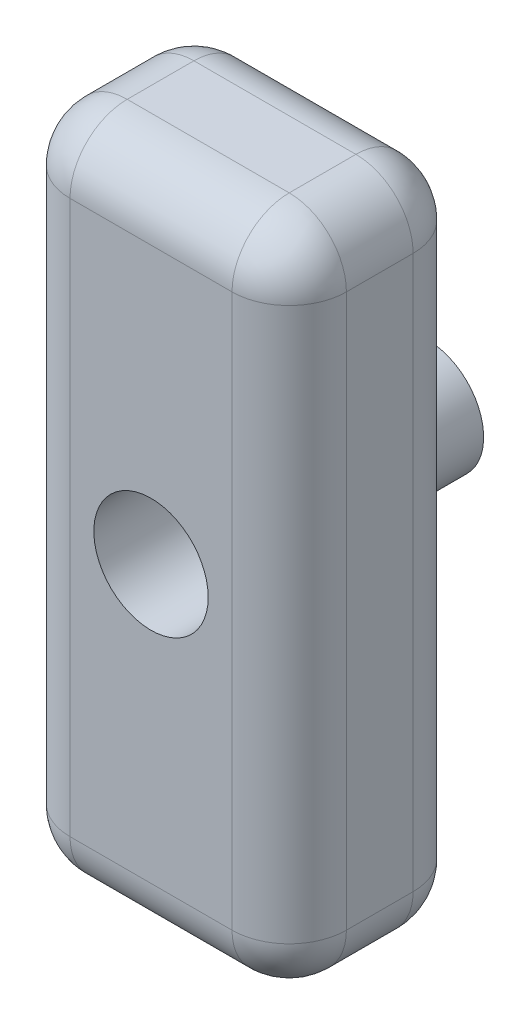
SolidWorks part; units mm, degrees
ref_plane "Спереди" through (0, 0, 0) normal (0, 0, 1) x (1, 0, 0)
ref_plane "Сверху" through (0, 0, 0) normal (0, 1, 0) x (1, 0, 0)
ref_plane "Справа" through (0, 0, 0) normal (1, 0, 0) x (0, 0, -1)
sketch "Эскиз2" plane through (0, 0, 0) normal (0, 0, 1) x (1, 0, 0)
  line L0 (24.5, 54.5) -> (10, 54.5)
  line L16 (-4.5, 54.5) -> (-4.5, -15.5)
  line L17 (24.5, 54.5) -> (24.5, -15.5)
  line L18 (10, 54.5) -> (-4.5, 54.5)
  line L19 (24.5, -15.5) -> (-4.5, -15.5)
extrude "Бобышка-Вытянуть1" add sketch "Эскиз2" along normal blind 19
sketch "Эскиз8" plane through (0, 0, 0) normal (0, 0, -1) x (-1, 0, 0)
  circle A0 centre (-10, 19.5) radius 5.9
extrude "Бобышка-Вытянуть2" add sketch "Эскиз8" along normal blind 10
fillet "Скругление2" radius 6 12 edges at (10, 54.5, 19) (10, 54.5, 0) (-4.5, 54.5, 9.5) (24.5, 54.5, 9.5) (-4.5, -15.5, 9.5) (24.5, -15.5, 9.5) (10, -15.5, 19) (10, -15.5, 0) (-4.5, 19.5, 0) (-4.5, 19.5, 19) (24.5, 19.5, 0) (24.5, 19.5, 19)
sketch "Эскиз9" plane through (0, 0, 19) normal (0, 0, 1) x (1, 0, 0)
  circle A0 centre (10, 19.5) radius 6
extrude "Вырез-Вытянуть1" cut sketch "Эскиз9" against normal blind 15
